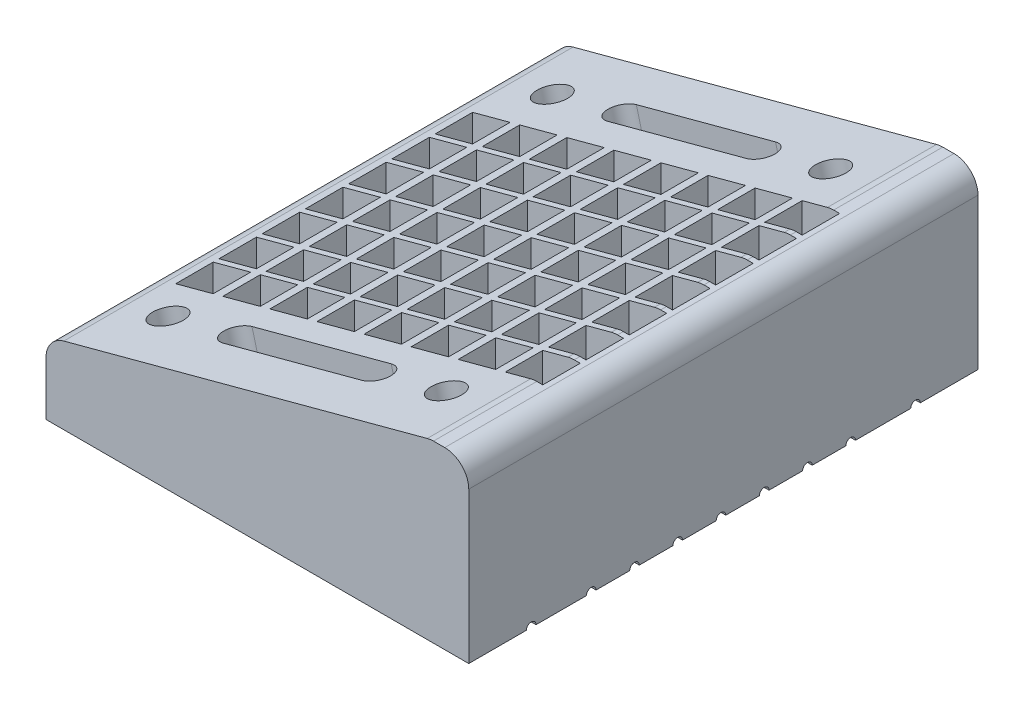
SolidWorks part; units mm, degrees
ref_plane "Front Plane" through (0, 0, 0) normal (0, 0, 1) x (1, 0, 0)
ref_plane "Top Plane" through (0, 0, 0) normal (0, 1, 0) x (1, 0, 0)
ref_plane "Right Plane" through (0, 0, 0) normal (1, 0, 0) x (0, 0, -1)
sketch "Sketch1" plane through (0, 0, 0) normal (0, 0, 1) x (1, 0, 0)
  line L0 (0, 0) -> (80, 0) construction
  line L1 (80, 0) -> (80, 21.4359) construction
  line L2 (80, 21.4359) -> (0, 0)
  line L3 (0, -15) -> (80, -15)
  line L5 (0, 0) -> (0, -15)
  line L8 (80, 21.4359) -> (80, 0) construction
  line L13 (80, -15) -> (88, -15)
  line L14 (80, -15) -> (80, 21.4359) construction
  line L15 (80, 21.4359) -> (88, 21.4359)
  line L16 (88, -15) -> (88, 21.4359)
  dimension "D1" = 80
  dimension "D2" = 15
  dimension "D3" = 8
  dimension "D4" = 15
extrude "Boss-Extrude1" add sketch "Sketch1" along normal blind 106
sketch "Sketch2" plane through (0, 0, 0) normal (-0.2588, 0.9659, 0) x (0.9659, 0.2588, 0)
  line L5 (82.8221, -106) -> (82.8221, 0) construction
  line L6 (12.8221, -93) -> (72.8221, -93)
  line L8 (12.8221, -93) -> (12.8221, -13)
  line L11 (12.8221, -13) -> (72.8221, -13)
  line L12 (72.8221, -93) -> (72.8221, -13)
  line L13 (12.8221, -93) -> (72.8221, -13) construction
  line L14 (12.8221, -13) -> (72.8221, -93) construction
  line L15 (82.8221, -53) -> (0, -53) construction
  line L16 (0, -106) -> (0, 0) construction
  point P0 (42.8221, -53)
  dimension "D1" = 60
  dimension "D2" = 80
  dimension "D3" = 10
hole_wizard "M6 Clearance Hole1" positions "Sketch2" profile "Sketch3" hole size "M6" standard "ANSI Metric"
sketch "Sketch3" plane through (70.3407, 18.8477, 93) normal (0, 0, 1) x (-0.9659, -0.2588, 0)
  line L0 (0, 0) -> (0, 37.265)
  line L1 (0, 37.265) -> (3.3, 37.265)
  line L2 (3.3, 37.265) -> (3.3, 0)
  line L5 (3.3, 0) -> (0, 0)
  line L11 (0, -6.35) -> (0, 107.95) construction
  dimension "Thru Hole Dia." = 6.6
  dimension "Thru Hole Depth" = 37.265
fillet "Fillet1" radius 5 3 edges at (88, 21.4359, 53) (80, 21.4359, 53) (0, 0, 53)
sketch "Sketch4" plane through (0, 0, 0) normal (-0.2588, 0.9659, 0) x (0.9659, 0.2588, 0)
  line L0 (27.8221, -16) -> (57.8221, -16)
  line L1 (27.8221, -13) -> (57.8221, -13) construction
  line L2 (27.8221, -13) -> (27.8221, -93) construction
  line L3 (27.8221, -93) -> (57.8221, -93) construction
  line L4 (57.8221, -13) -> (57.8221, -93) construction
  line L5 (27.8221, -96) -> (57.8221, -96)
  line L6 (27.8221, -10) -> (57.8221, -10)
  line L7 (27.8221, -90) -> (57.8221, -90)
  circle A0 centre (72.8221, -13) radius 3.3 construction
  arc A2 (27.8221, -16) -> (27.8221, -10) centre (27.8221, -13) cw
  arc A3 (57.8221, -16) -> (57.8221, -10) centre (57.8221, -13) ccw
  arc A4 (27.8221, -96) -> (27.8221, -90) centre (27.8221, -93) cw
  arc A5 (57.8221, -96) -> (57.8221, -90) centre (57.8221, -93) ccw
  dimension "D3" = 15
  dimension "D1" = 30
  dimension "D2" = 80
extrude "Cut-Extrude1" cut sketch "Sketch4" against normal through all both and the other way through all
sketch "Sketch5" plane through (0, -15, 0) normal (0, -1, 0) x (1, 0, 0)
  line L0 (15.3, 84.5) -> (15.3, 76.7)
  line L1 (5.5, 84.5) -> (13.3, 84.5)
  line L2 (5.5, 84.5) -> (5.5, 76.7)
  line L3 (5.5, 76.7) -> (13.3, 76.7)
  line L4 (13.3, 84.5) -> (13.3, 76.7)
  line L5 (15.3, 84.5) -> (23.1, 84.5)
  line L6 (0, 106) -> (0, 0) construction
  line L7 (23.1, 84.5) -> (23.1, 76.7)
  line L8 (63.8811, 90) -> (32.8228, 90) construction
  line L9 (15.3, 76.7) -> (23.1, 76.7)
  line L10 (25.1, 84.5) -> (25.1, 76.7)
  line L11 (25.1, 84.5) -> (32.9, 84.5)
  line L12 (32.9, 84.5) -> (32.9, 76.7)
  line L13 (25.1, 76.7) -> (32.9, 76.7)
  line L14 (34.9, 84.5) -> (34.9, 76.7)
  line L15 (34.9, 84.5) -> (42.7, 84.5)
  line L16 (42.7, 84.5) -> (42.7, 76.7)
  line L17 (34.9, 76.7) -> (42.7, 76.7)
  line L18 (44.7, 84.5) -> (44.7, 76.7)
  line L19 (44.7, 84.5) -> (52.5, 84.5)
  line L20 (52.5, 84.5) -> (52.5, 76.7)
  line L21 (44.7, 76.7) -> (52.5, 76.7)
  line L22 (54.5, 84.5) -> (54.5, 76.7)
  line L23 (54.5, 84.5) -> (62.3, 84.5)
  line L24 (62.3, 84.5) -> (62.3, 76.7)
  line L25 (54.5, 76.7) -> (62.3, 76.7)
  line L26 (64.3, 84.5) -> (64.3, 76.7)
  line L27 (64.3, 84.5) -> (72.1, 84.5)
  line L28 (72.1, 84.5) -> (72.1, 76.7)
  line L29 (64.3, 76.7) -> (72.1, 76.7)
  line L30 (15.3, 75.5) -> (15.3, 67.7)
  line L31 (15.3, 75.5) -> (23.1, 75.5)
  line L32 (23.1, 75.5) -> (23.1, 67.7)
  line L33 (15.3, 67.7) -> (23.1, 67.7)
  line L34 (25.1, 75.5) -> (25.1, 67.7)
  line L35 (25.1, 75.5) -> (32.9, 75.5)
  line L36 (32.9, 75.5) -> (32.9, 67.7)
  line L37 (25.1, 67.7) -> (32.9, 67.7)
  line L38 (34.9, 75.5) -> (34.9, 67.7)
  line L39 (34.9, 75.5) -> (42.7, 75.5)
  line L40 (42.7, 75.5) -> (42.7, 67.7)
  line L41 (34.9, 67.7) -> (42.7, 67.7)
  line L42 (44.7, 75.5) -> (44.7, 67.7)
  line L43 (44.7, 75.5) -> (52.5, 75.5)
  line L44 (52.5, 75.5) -> (52.5, 67.7)
  line L45 (44.7, 67.7) -> (52.5, 67.7)
  line L46 (54.5, 75.5) -> (54.5, 67.7)
  line L47 (54.5, 75.5) -> (62.3, 75.5)
  line L48 (62.3, 75.5) -> (62.3, 67.7)
  line L49 (54.5, 67.7) -> (62.3, 67.7)
  line L50 (64.3, 75.5) -> (64.3, 67.7)
  line L51 (64.3, 75.5) -> (72.1, 75.5)
  line L52 (72.1, 75.5) -> (72.1, 67.7)
  line L53 (64.3, 67.7) -> (72.1, 67.7)
  line L54 (15.3, 66.5) -> (15.3, 58.7)
  line L55 (15.3, 66.5) -> (23.1, 66.5)
  line L56 (23.1, 66.5) -> (23.1, 58.7)
  line L57 (15.3, 58.7) -> (23.1, 58.7)
  line L58 (25.1, 66.5) -> (25.1, 58.7)
  line L59 (25.1, 66.5) -> (32.9, 66.5)
  line L60 (32.9, 66.5) -> (32.9, 58.7)
  line L61 (25.1, 58.7) -> (32.9, 58.7)
  line L62 (34.9, 66.5) -> (34.9, 58.7)
  line L63 (34.9, 66.5) -> (42.7, 66.5)
  line L64 (42.7, 66.5) -> (42.7, 58.7)
  line L65 (34.9, 58.7) -> (42.7, 58.7)
  line L66 (44.7, 66.5) -> (44.7, 58.7)
  line L67 (44.7, 66.5) -> (52.5, 66.5)
  line L68 (52.5, 66.5) -> (52.5, 58.7)
  line L69 (44.7, 58.7) -> (52.5, 58.7)
  line L70 (54.5, 66.5) -> (54.5, 58.7)
  line L71 (54.5, 66.5) -> (62.3, 66.5)
  line L72 (62.3, 66.5) -> (62.3, 58.7)
  line L73 (54.5, 58.7) -> (62.3, 58.7)
  line L74 (64.3, 66.5) -> (64.3, 58.7)
  line L75 (64.3, 66.5) -> (72.1, 66.5)
  line L76 (72.1, 66.5) -> (72.1, 58.7)
  line L77 (64.3, 58.7) -> (72.1, 58.7)
  line L78 (15.3, 57.5) -> (15.3, 49.7)
  line L79 (15.3, 57.5) -> (23.1, 57.5)
  line L80 (23.1, 57.5) -> (23.1, 49.7)
  line L81 (15.3, 49.7) -> (23.1, 49.7)
  line L82 (25.1, 57.5) -> (25.1, 49.7)
  line L83 (25.1, 57.5) -> (32.9, 57.5)
  line L84 (32.9, 57.5) -> (32.9, 49.7)
  line L85 (25.1, 49.7) -> (32.9, 49.7)
  line L86 (34.9, 57.5) -> (34.9, 49.7)
  line L87 (34.9, 57.5) -> (42.7, 57.5)
  line L88 (42.7, 57.5) -> (42.7, 49.7)
  line L89 (34.9, 49.7) -> (42.7, 49.7)
  line L90 (44.7, 57.5) -> (44.7, 49.7)
  line L91 (44.7, 57.5) -> (52.5, 57.5)
  line L92 (52.5, 57.5) -> (52.5, 49.7)
  line L93 (44.7, 49.7) -> (52.5, 49.7)
  line L94 (54.5, 57.5) -> (54.5, 49.7)
  line L95 (54.5, 57.5) -> (62.3, 57.5)
  line L96 (62.3, 57.5) -> (62.3, 49.7)
  line L97 (54.5, 49.7) -> (62.3, 49.7)
  line L98 (64.3, 57.5) -> (64.3, 49.7)
  line L99 (64.3, 57.5) -> (72.1, 57.5)
  line L100 (72.1, 57.5) -> (72.1, 49.7)
  line L101 (64.3, 49.7) -> (72.1, 49.7)
  line L102 (15.3, 48.5) -> (15.3, 40.7)
  line L103 (15.3, 48.5) -> (23.1, 48.5)
  line L104 (23.1, 48.5) -> (23.1, 40.7)
  line L105 (15.3, 40.7) -> (23.1, 40.7)
  line L106 (25.1, 48.5) -> (25.1, 40.7)
  line L107 (25.1, 48.5) -> (32.9, 48.5)
  line L108 (32.9, 48.5) -> (32.9, 40.7)
  line L109 (25.1, 40.7) -> (32.9, 40.7)
  line L110 (34.9, 48.5) -> (34.9, 40.7)
  line L111 (34.9, 48.5) -> (42.7, 48.5)
  line L112 (42.7, 48.5) -> (42.7, 40.7)
  line L113 (34.9, 40.7) -> (42.7, 40.7)
  line L114 (44.7, 48.5) -> (44.7, 40.7)
  line L115 (44.7, 48.5) -> (52.5, 48.5)
  line L116 (52.5, 48.5) -> (52.5, 40.7)
  line L117 (44.7, 40.7) -> (52.5, 40.7)
  line L118 (54.5, 48.5) -> (54.5, 40.7)
  line L119 (54.5, 48.5) -> (62.3, 48.5)
  line L120 (62.3, 48.5) -> (62.3, 40.7)
  line L121 (54.5, 40.7) -> (62.3, 40.7)
  line L122 (64.3, 48.5) -> (64.3, 40.7)
  line L123 (64.3, 48.5) -> (72.1, 48.5)
  line L124 (72.1, 48.5) -> (72.1, 40.7)
  line L125 (64.3, 40.7) -> (72.1, 40.7)
  line L126 (15.3, 39.5) -> (15.3, 31.7)
  line L127 (15.3, 39.5) -> (23.1, 39.5)
  line L128 (23.1, 39.5) -> (23.1, 31.7)
  line L129 (15.3, 31.7) -> (23.1, 31.7)
  line L130 (25.1, 39.5) -> (25.1, 31.7)
  line L131 (25.1, 39.5) -> (32.9, 39.5)
  line L132 (32.9, 39.5) -> (32.9, 31.7)
  line L133 (25.1, 31.7) -> (32.9, 31.7)
  line L134 (34.9, 39.5) -> (34.9, 31.7)
  line L135 (34.9, 39.5) -> (42.7, 39.5)
  line L136 (42.7, 39.5) -> (42.7, 31.7)
  line L137 (34.9, 31.7) -> (42.7, 31.7)
  line L138 (44.7, 39.5) -> (44.7, 31.7)
  line L139 (44.7, 39.5) -> (52.5, 39.5)
  line L140 (52.5, 39.5) -> (52.5, 31.7)
  line L141 (44.7, 31.7) -> (52.5, 31.7)
  line L142 (54.5, 39.5) -> (54.5, 31.7)
  line L143 (54.5, 39.5) -> (62.3, 39.5)
  line L144 (62.3, 39.5) -> (62.3, 31.7)
  line L145 (54.5, 31.7) -> (62.3, 31.7)
  line L146 (64.3, 39.5) -> (64.3, 31.7)
  line L147 (64.3, 39.5) -> (72.1, 39.5)
  line L148 (72.1, 39.5) -> (72.1, 31.7)
  line L149 (64.3, 31.7) -> (72.1, 31.7)
  line L150 (5.5, 75.5) -> (5.5, 67.7)
  line L151 (5.5, 75.5) -> (13.3, 75.5)
  line L152 (13.3, 75.5) -> (13.3, 67.7)
  line L153 (5.5, 67.7) -> (13.3, 67.7)
  line L154 (5.5, 66.5) -> (5.5, 58.7)
  line L155 (5.5, 66.5) -> (13.3, 66.5)
  line L156 (13.3, 66.5) -> (13.3, 58.7)
  line L157 (5.5, 58.7) -> (13.3, 58.7)
  line L158 (5.5, 57.5) -> (5.5, 49.7)
  line L159 (5.5, 57.5) -> (13.3, 57.5)
  line L160 (13.3, 57.5) -> (13.3, 49.7)
  line L161 (5.5, 49.7) -> (13.3, 49.7)
  line L162 (5.5, 48.5) -> (5.5, 40.7)
  line L163 (5.5, 48.5) -> (13.3, 48.5)
  line L164 (13.3, 48.5) -> (13.3, 40.7)
  line L165 (5.5, 40.7) -> (13.3, 40.7)
  line L166 (5.5, 39.5) -> (5.5, 31.7)
  line L167 (5.5, 39.5) -> (13.3, 39.5)
  line L168 (13.3, 39.5) -> (13.3, 31.7)
  line L169 (5.5, 31.7) -> (13.3, 31.7)
  line L170 (5.5, 84.5) -> (15.3, 84.5) construction
  line L171 (5.5, 30.5) -> (5.5, 22.7)
  line L172 (5.5, 30.5) -> (13.3, 30.5)
  line L173 (13.3, 30.5) -> (13.3, 22.7)
  line L174 (5.5, 22.7) -> (13.3, 22.7)
  line L175 (15.3, 30.5) -> (15.3, 22.7)
  line L176 (15.3, 30.5) -> (23.1, 30.5)
  line L177 (23.1, 30.5) -> (23.1, 22.7)
  line L178 (15.3, 22.7) -> (23.1, 22.7)
  line L179 (25.1, 30.5) -> (25.1, 22.7)
  line L180 (25.1, 30.5) -> (32.9, 30.5)
  line L181 (32.9, 30.5) -> (32.9, 22.7)
  line L182 (25.1, 22.7) -> (32.9, 22.7)
  line L183 (34.9, 30.5) -> (34.9, 22.7)
  line L184 (34.9, 30.5) -> (42.7, 30.5)
  line L185 (42.7, 30.5) -> (42.7, 22.7)
  line L186 (34.9, 22.7) -> (42.7, 22.7)
  line L187 (44.7, 30.5) -> (44.7, 22.7)
  line L188 (44.7, 30.5) -> (52.5, 30.5)
  line L189 (52.5, 30.5) -> (52.5, 22.7)
  line L190 (44.7, 22.7) -> (52.5, 22.7)
  line L191 (54.5, 30.5) -> (54.5, 22.7)
  line L192 (54.5, 30.5) -> (62.3, 30.5)
  line L193 (62.3, 30.5) -> (62.3, 22.7)
  line L194 (54.5, 22.7) -> (62.3, 22.7)
  line L195 (64.3, 30.5) -> (64.3, 22.7)
  line L196 (64.3, 30.5) -> (72.1, 30.5)
  line L197 (72.1, 30.5) -> (72.1, 22.7)
  line L198 (64.3, 22.7) -> (72.1, 22.7)
  line L199 (74.1, 84.5) -> (74.1, 76.7)
  line L200 (74.1, 84.5) -> (81.9, 84.5)
  line L201 (81.9, 84.5) -> (81.9, 76.7)
  line L202 (74.1, 76.7) -> (81.9, 76.7)
  line L203 (74.1, 75.5) -> (74.1, 67.7)
  line L204 (74.1, 75.5) -> (81.9, 75.5)
  line L205 (81.9, 75.5) -> (81.9, 67.7)
  line L206 (74.1, 67.7) -> (81.9, 67.7)
  line L207 (74.1, 66.5) -> (74.1, 58.7)
  line L208 (74.1, 66.5) -> (81.9, 66.5)
  line L209 (81.9, 66.5) -> (81.9, 58.7)
  line L210 (74.1, 58.7) -> (81.9, 58.7)
  line L211 (74.1, 57.5) -> (74.1, 49.7)
  line L212 (74.1, 57.5) -> (81.9, 57.5)
  line L213 (81.9, 57.5) -> (81.9, 49.7)
  line L214 (74.1, 49.7) -> (81.9, 49.7)
  line L215 (74.1, 48.5) -> (74.1, 40.7)
  line L216 (74.1, 48.5) -> (81.9, 48.5)
  line L217 (81.9, 48.5) -> (81.9, 40.7)
  line L218 (74.1, 40.7) -> (81.9, 40.7)
  line L219 (74.1, 39.5) -> (74.1, 31.7)
  line L220 (74.1, 39.5) -> (81.9, 39.5)
  line L221 (81.9, 39.5) -> (81.9, 31.7)
  line L222 (74.1, 31.7) -> (81.9, 31.7)
  line L223 (74.1, 30.5) -> (74.1, 22.7)
  line L224 (74.1, 30.5) -> (81.9, 30.5)
  line L225 (81.9, 30.5) -> (81.9, 22.7)
  line L226 (74.1, 22.7) -> (81.9, 22.7)
extrude "Cut-Extrude2" cut sketch "Sketch5" against normal through all both and the other way through all
sketch "Sketch6" plane through (88, 0, 0) normal (1, 0, 0) x (0, 0, -1)
  line L1 (-106, -15) -> (0, -15) construction
  line L2 (-106, -15) -> (-106, 16.4359) construction
  line L3 (-80.5, -15) -> (-71.5, -15) construction
  line L4 (0, -15) -> (0, 16.4359) construction
  circle A1 centre (-80.5, -15) radius 1
  circle A2 centre (-71.5, -15) radius 1
  circle A3 centre (-62.5, -15) radius 1
  circle A4 centre (-53.5, -15) radius 1
  circle A5 centre (-44.5, -15) radius 1
  circle A6 centre (-35.5, -15) radius 1
  circle A7 centre (-26.5, -15) radius 1
  circle A8 centre (-93, -15) radius 1
  circle A9 centre (-13, -15) radius 1
extrude "Cut-Extrude3" cut sketch "Sketch6" against normal through all both and the other way through all
equation "\"D4@Sketch5\"=\"D2@Sketch5\""
equation "\"D5@Sketch6\"=\"D1@Sketch6\""
equation "\"D6@Sketch6\"=\"D1@Sketch6\""
equation "\"D8@Sketch6\"=\"D7@Sketch6\""
